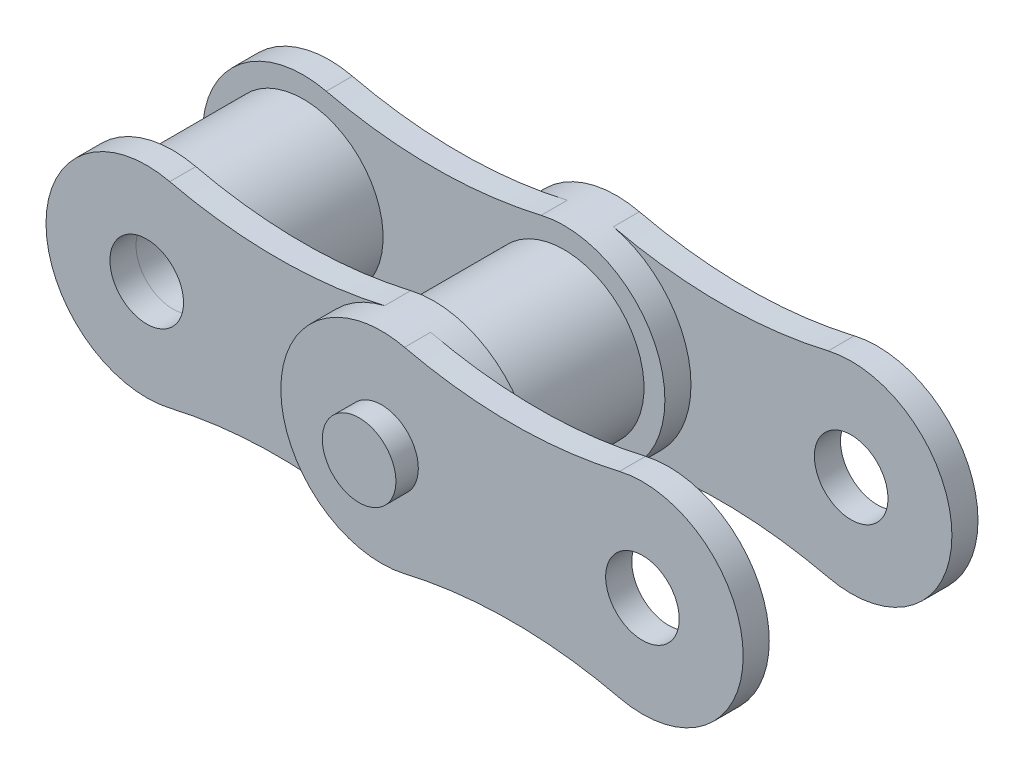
SolidWorks part; units mm, degrees
ref_plane "Front Plane" through (0, 0, 0) normal (0, 0, 1) x (1, 0, 0)
ref_plane "Top Plane" through (0, 0, 0) normal (0, 1, 0) x (1, 0, 0)
ref_plane "Right Plane" through (0, 0, 0) normal (1, 0, 0) x (0, 0, -1)
sketch "Sketch1" plane through (0, 0, 0) normal (0, 0, 1) x (1, 0, 0)
  line L0 (-6.35, 0) -> (6.35, 0) construction
  line L1 (-6.35, 4.9022) -> (-6.35, -4.9022) construction
  line L2 (0, -4.1669) -> (0, 4.1669) construction
  line L3 (6.35, -4.9022) -> (6.35, 4.9022) construction
  circle A0 centre (-6.35, 0) radius 3.8862
  circle A1 centre (6.35, 0) radius 3.8862
  circle A2 centre (-6.35, 0) radius 1.7907
  circle A3 centre (6.35, 0) radius 1.7907
  arc A4 (-5.2297, 4.7725) -> (-5.2297, -4.7725) centre (-6.35, 0) ccw
  arc A5 (5.2297, -4.7725) -> (5.2297, 4.7725) centre (6.35, 0) ccw
  arc A6 (-5.2297, 4.7725) -> (5.2297, 4.7725) centre (0, 27.0503) ccw
  arc A7 (-5.2297, -4.7725) -> (5.2297, -4.7725) centre (0, -27.0503) cw
sketch "Sketch2" plane through (0, 0, 0) normal (0, 1, 0) x (1, 0, 0)
  line L0 (0, 3.175) -> (0, -3.175) construction
  point P2 (0, -4.445)
  point P4 (0, 4.445)
  point P5 (0, 4.4958)
  point P6 (0, 5.7658)
ref_plane "Plane1" through (0, 0, 3.175) normal (0, 0, 1) x (1, 0, 0)
ref_plane "Plane2" through (0, 0, -4.4958) normal (0, 0, 1) x (1, 0, 0)
sketch "Sketch4" plane through (0, 0, 0) normal (0, 0, 1) x (1, 0, 0)
  circle A0 centre (-6.35, 0) radius 3.8862 construction
  circle A1 centre (-6.35, 0) radius 3.8862
  circle A2 centre (6.35, 0) radius 3.8862 construction
  circle A3 centre (6.35, 0) radius 3.8862
  circle A4 centre (-6.35, 0) radius 1.8161
  circle A5 centre (6.35, 0) radius 1.8161
extrude "Boss-Extrude1" add sketch "Sketch4" along normal mid plane 6.35
sketch "Sketch5" plane through (0, 0, 3.175) normal (0, 0, 1) x (1, 0, 0)
  arc A0 (-5.2297, 4.7725) -> (-5.2297, -4.7725) centre (-6.35, 0) ccw construction
  arc A1 (-5.2297, 4.7725) -> (5.2297, 4.7725) centre (0, 27.0503) ccw construction
  circle A2 centre (-6.35, 0) radius 1.7907 construction
  arc A3 (5.2297, -4.7725) -> (5.2297, 4.7725) centre (6.35, 0) ccw construction
  circle A4 centre (6.35, 0) radius 1.7907 construction
  arc A5 (5.2297, -4.7725) -> (-5.2297, -4.7725) centre (0, -27.0503) ccw construction
  arc A6 (-5.2297, 4.7725) -> (-5.2297, -4.7725) centre (-6.35, 0) ccw
  arc A7 (-5.2297, 4.7725) -> (5.2297, 4.7725) centre (0, 27.0503) ccw
  circle A8 centre (-6.35, 0) radius 1.7907
  arc A9 (5.2297, -4.7725) -> (5.2297, 4.7725) centre (6.35, 0) ccw
  circle A10 centre (6.35, 0) radius 1.7907
  arc A11 (5.2297, -4.7725) -> (-5.2297, -4.7725) centre (0, -27.0503) ccw
extrude "Boss-Extrude2" add sketch "Sketch5" along normal up to vertex (1.27 mm away) separate body
mirror "Mirror3" about plane through (0, 0, 0) normal (0, 0, 1)
combine bodies "Combine2" operation type add bodies to combine 120 103 102 101
ref_plane "Plane4" through (0, 0, 4.445) normal (0, 0, 1) x (1, 0, 0)
sketch "Sketch8" plane through (0, 0, 4.445) normal (0, 0, 1) x (1, 0, 0)
  circle A6 centre (19.05, 0) radius 1.7907
  circle A7 centre (6.35, 0) radius 1.7907
  arc A8 (7.4703, 4.7725) -> (7.4703, -4.7725) centre (6.35, 0) ccw
  arc A9 (17.9297, -4.7725) -> (7.4703, -4.7725) centre (12.7, -27.0503) ccw
  arc A10 (17.9297, -4.7725) -> (17.9297, 4.7725) centre (19.05, 0) ccw
  arc A11 (7.4703, 4.7725) -> (17.9297, 4.7725) centre (12.7, 27.0503) ccw
ref_plane "Plane5" through (0, 0, -4.445) normal (0, 0, -1) x (-1, 0, 0)
sketch "Sketch9" plane through (0, 0, -4.445) normal (0, 0, -1) x (-1, 0, 0)
  circle A0 centre (-19.05, 0) radius 1.7907 construction
  arc A1 (-17.9297, 4.7725) -> (-17.9297, -4.7725) centre (-19.05, 0) ccw construction
  arc A2 (-7.4703, -4.7725) -> (-17.9297, -4.7725) centre (-12.7, -27.0503) ccw construction
  circle A3 centre (-6.35, 0) radius 1.7907 construction
  arc A4 (-7.4703, -4.7725) -> (-7.4703, 4.7725) centre (-6.35, 0) ccw construction
  arc A5 (-17.9297, 4.7725) -> (-7.4703, 4.7725) centre (-12.7, 27.0503) ccw construction
  circle A6 centre (-19.05, 0) radius 1.7907
  arc A7 (-17.9297, 4.7725) -> (-17.9297, -4.7725) centre (-19.05, 0) ccw
  arc A8 (-7.4703, -4.7725) -> (-17.9297, -4.7725) centre (-12.7, -27.0503) ccw
  circle A9 centre (-6.35, 0) radius 1.7907
  arc A10 (-7.4703, -4.7725) -> (-7.4703, 4.7725) centre (-6.35, 0) ccw
  arc A11 (-17.9297, 4.7725) -> (-7.4703, 4.7725) centre (-12.7, 27.0503) ccw
extrude "Boss-Extrude3" add sketch "Sketch8" along normal blind 1.27
extrude "Boss-Extrude4" add sketch "Sketch9" along normal blind 1.27
ref_plane "Plane6" through (0, 0, -6.7056) normal (0, 0, -1) x (-1, 0, 0)
sketch "Sketch10" plane through (0, 0, -6.7056) normal (0, 0, -1) x (-1, 0, 0)
  circle A0 centre (-6.35, 0) radius 1.7907 construction
  circle A1 centre (-6.35, 0) radius 1.7907
extrude "Boss-Extrude5" add sketch "Sketch10" against normal blind 13.5128 contours A1
equation "\"D2@Sketch1\" =\"H@Sketch1\"*.85"
equation "\"D1@Sketch2\" = \"T@Sketch2\""
equation "\"D1@Sketch4\" = \"Pin Dia@Sketch1\"+.002"
equation "\"D2@Sketch4\" = \"D1@Sketch4\""
equation "\"D1@Boss-Extrude1\" = \"W@Sketch2\""
equation "\"D2@Sketch2\" = \"T@Sketch2\""
